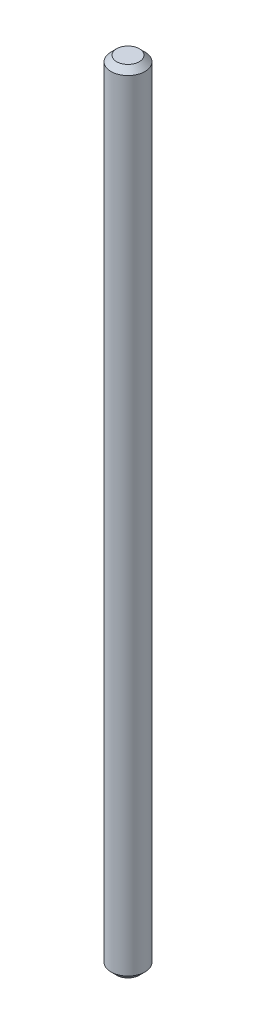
SolidWorks part; units mm, degrees
ref_plane "Plan de face" through (0, 0, 0) normal (0, 0, 1) x (1, 0, 0)
ref_plane "Plan de dessus" through (0, 0, 0) normal (0, 1, 0) x (1, 0, 0)
ref_plane "Plan de droite" through (0, 0, 0) normal (1, 0, 0) x (0, 0, -1)
sketch "Esquisse1" plane through (0, 0, 0) normal (0, 0, 1) x (1, 0, 0)
  line L0 (0, 0) -> (-1, 0)
  line L1 (-1.5, 0.5) -> (-1.5, 69.5)
  line L2 (-1, 70) -> (0, 70)
  line L3 (0, 70) -> (0, 0) construction
  line L4 (-1.5, 69.5) -> (-1, 70)
  line L5 (-1, 0) -> (-1.5, 0.5)
  line L6 (0, 0) -> (0, 70)
  point P1 (-1.5, 0)
  point P4 (-1.5, 70)
  dimension "D1" = 0.5
  dimension "D2" = 45
  dimension "D3" = 45
revolve "Révolution1" add sketch "Esquisse1" angle 360 about L3
equation "\"D1@Esquisse1\" = \"D\"/6"
